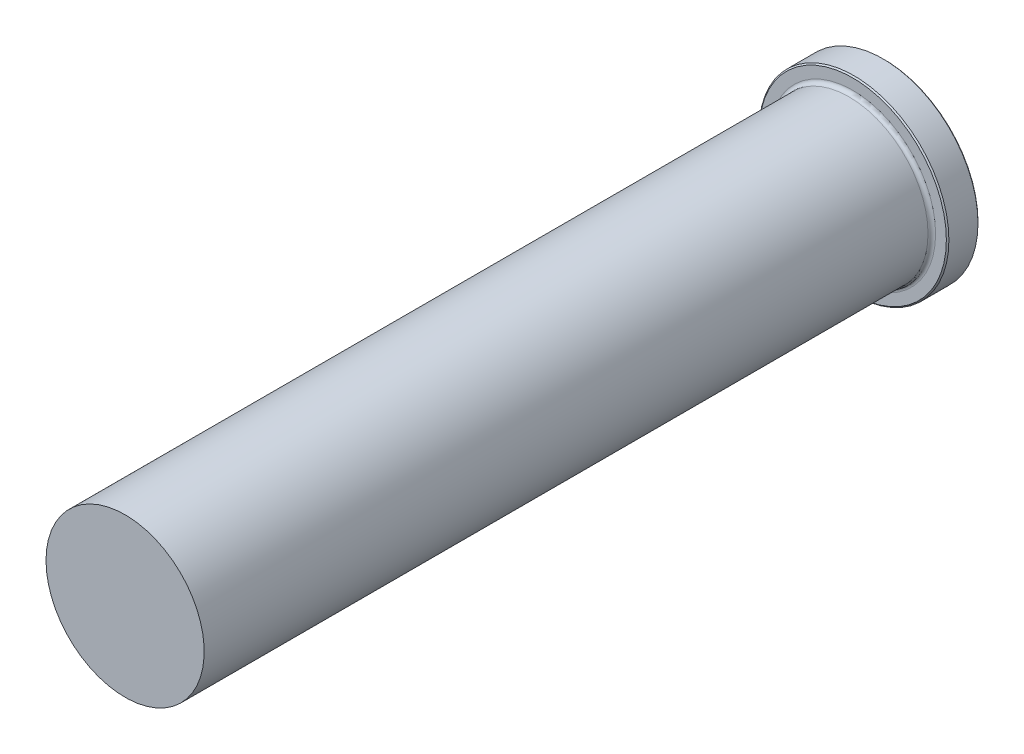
SolidWorks part; units mm, degrees
ref_plane "Front Plane" through (0, 0, 0) normal (0, 0, 1) x (1, 0, 0)
ref_plane "Top Plane" through (0, 0, 0) normal (0, 1, 0) x (1, 0, 0)
ref_plane "Right Plane" through (0, 0, 0) normal (1, 0, 0) x (0, 0, -1)
sketch "Sketch1" plane through (0, 0, 0) normal (1, 0, 0) x (0, 0, -1)
  line L0 (0, 0) -> (-156.8087, 0) construction
  line L1 (0, 0) -> (0, 19.05)
  line L2 (0, 19.05) -> (-6.35, 19.05)
  line L3 (-6.35, 19.05) -> (-6.35, 15.875)
  line L4 (-6.35, 15.875) -> (-152.4, 15.875)
  line L5 (-152.4, 15.875) -> (-152.4, 0)
  line L6 (-152.4, 0) -> (0, 0)
  dimension "D1" = 38.1
  dimension "D2" = 31.75
  dimension "D3" = 6.35
  dimension "D4" = 152.4
revolve "Revolve1" add sketch "Sketch1" angle 360 about L0
fillet "Fillet1" radius 0.762 1 edges at (-15.875, 0, 6.35)
chamfer "Chamfer1" distance 0.254 angle 45 2 edges at (-19.05, 0, 0) (-19.05, 0, 6.35)
